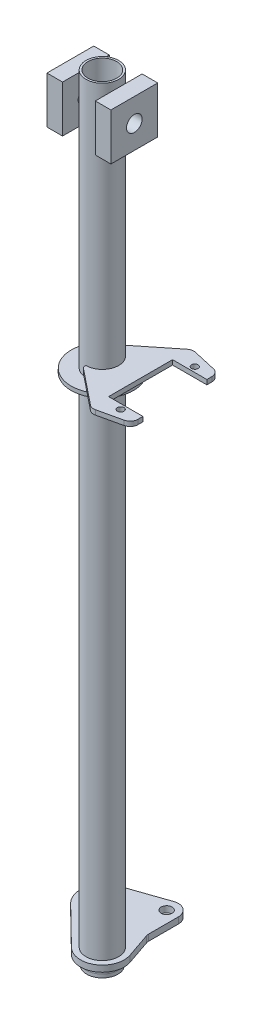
SolidWorks part; units mm, degrees
ref_plane "Plan de face" through (0, 0, 0) normal (0, 0, 1) x (1, 0, 0)
ref_plane "Plan de dessus" through (0, 0, 0) normal (0, 1, 0) x (1, 0, 0)
ref_plane "Plan de droite" through (0, 0, 0) normal (1, 0, 0) x (0, 0, -1)
sketch "Esquisse1" plane through (0, 0, 0) normal (0, 1, 0) x (1, 0, 0)
  line L0 (-57.9022, 78.2534) -> (-4.9011, 96.5767)
  line L1 (15, 82.4) -> (15, 44.3612)
  line L2 (15.5371, 41.128) -> (26.4961, 9.0529)
  line L3 (-19.5901, -20.0057) -> (-69.0894, 28.4653)
  circle A0 centre (0, 0) radius 21
  circle A1 centre (-48.1, 49.9) radius 15
  circle A2 centre (0, 82.4) radius 7
  arc A3 (-4.9011, 96.5767) -> (15, 82.4) centre (0, 82.4) cw
  arc A4 (26.4961, 9.0529) -> (-19.5901, -20.0057) centre (0, 0) cw
  arc A5 (-69.0894, 28.4653) -> (-57.9022, 78.2534) centre (-48.1, 49.9) cw
  arc A6 (15, 44.3612) -> (15.5371, 41.128) centre (25, 44.3612) ccw
  point P11 (15, 42.7)
  dimension "D1" = 30
  dimension "D2" = 42
  dimension "D3" = 14
  dimension "D4" = 15
  dimension "D5" = 28
  dimension "D6" = 30
  dimension "D12" = 10
  dimension "D7" = 49.9
  dimension "D8" = 48.1
  dimension "D9" = 48.1
  dimension "D10" = 82.4
  dimension "D11" = 42.7
extrude "Extrusion1" add sketch "Esquisse1" along normal blind 8
sketch "Esquisse2" plane through (0, 0, 0) normal (1, 0, 0) x (0, 0, -1)
  line L0 (0, -7) -> (0, 982)
  dimension "D1" = 7
  dimension "D2" = 989
other "Elément mécano-soudé1"
ref_plane "Plan1" through (0, -7, 0) normal (0, 1, 0) x (-1, 0, 0)
sketch "Esquisse11" plane through (0, -7, 0) normal (0, 1, 0) x (-1, 0, 0)
  line L0 (-21, 0) -> (21, 0) construction
  line L1 (0, 21) -> (0, -21) construction
  circle A0 centre (0, 0) radius 21
  circle A1 centre (0, 0) radius 18.5
  point P8 (0, 0)
  dimension "D1" = 37
  dimension "D2" = 42
inserted part "laser rondelle haut guidon"
move or copy body "Corps-Déplacer/Copier2" placed by mates yes
other "Distance1" parameters "D1"=638
other "<laser rondelle haut guidon>-<Extrusion1>"
sketch "Esquisse12" plane through (0, 8, 0) normal (0, 1, 0) x (-1, 0, 0)
  point P0 (48.1, -49.9)
ref_plane "Plan2" through (0, 0, 0) normal (-0.72, 0, 0.694) x (0.694, 0, 0.72)
sketch "Esquisse13" plane through (0, 0, 0) normal (-0.72, 0, 0.694) x (0.694, 0, 0.72)
  line L0 (-69.3082, -3) -> (-69.3082, 81)
  dimension "D1" = 11
  dimension "D2" = 73
other "Elément mécano-soudé2"
ref_plane "Plan3" through (-48.1, -3, -49.9) normal (0, 1, 0) x (-1, 0, 0)
sketch "Esquisse14" plane through (-48.1, -3, -49.9) normal (0, 1, 0) x (-1, 0, 0)
  line L0 (-15, 0) -> (15, 0) construction
  line L1 (0, 15) -> (0, -15) construction
  circle A0 centre (0, 0) radius 15
  point P7 (0, 0)
  dimension "D1" = 30
chamfer "Chanfrein1" distance 2 angle 45 1 edges at (-48.1, 81, -34.9)
sketch "Esquisse16" plane through (0, 0, 0) normal (1, 0, 0) x (0, 0, -1)
  line L0 (0, -7) -> (0, 982) construction
  line L1 (21, 982) -> (-21, 982) construction
  circle A0 centre (0, 943) radius 10
  dimension "D2" = 20
  dimension "D1" = 39
extrude "Enlèv. mat.-Extru.1" cut sketch "Esquisse16" against normal through all and the other way through all
inserted part "laser fix joystick"
move or copy body "Corps-Déplacer/Copier4" placed by mates yes
other "Distance3" parameters "D1"=7.3
other "<laser fix joystick>-<Extrusion1>"
sketch "Esquisse17" plane through (0, -7, 0) normal (0, -1, 0) x (1, 0, 0)
  circle A0 centre (0, 0) radius 20
  dimension "D1" = 40
extrude "Extrusion2" add sketch "Esquisse17" along normal blind 5 separate body
ref_plane "Plan4" through (21, 0, 0) normal (1, 0, 0) x (0, 0, -1)
ref_plane "Plan5" through (-21, 0, 0) normal (1, 0, 0) x (0, 0, -1)
sketch "Esquisse18" plane through (21, 0, 0) normal (1, 0, 0) x (0, 0, -1)
  line L0 (-30, 943) -> (30, 943)
  line L1 (30, 943) -> (-30, 943)
  point P3 (0, 943)
  dimension "D1" = 60
other "Elément mécano-soudé3"
ref_plane "Plan6" through (21, 943, 30) normal (0, 0, -1) x (-1, 0, 0)
sketch "Esquisse110" plane through (31, 943, 30) normal (0, 0, -1) x (-1, 0, 0)
  line L0 (-10, 0) -> (10, 0) construction
  line L1 (-10, 30) -> (10, 30)
  line L2 (-10, 30) -> (-10, -30)
  line L3 (-10, -30) -> (10, -30)
  line L4 (10, 30) -> (10, -30)
  line L5 (0, 30) -> (0, -30) construction
  point P8 (0, 0)
  dimension "D1" = 60
  dimension "D2" = 20
sketch "Esquisse111" plane through (-21, 0, 0) normal (1, 0, 0) x (0, 0, -1)
  line L0 (-30, 943) -> (30, 943)
other "Elément mécano-soudé5"
ref_plane "Plan8" through (-21, 943, 30) normal (0, 0, -1) x (-1, 0, 0)
sketch "Esquisse113" plane through (-31, 943, 30) normal (0, 0, -1) x (-1, 0, 0)
  line L0 (-10, 0) -> (10, 0) construction
  line L1 (-10, 30) -> (10, 30)
  line L2 (-10, 30) -> (-10, -30)
  line L3 (-10, -30) -> (10, -30)
  line L4 (10, 30) -> (10, -30)
  line L5 (0, 30) -> (0, -30) construction
  point P8 (0, 0)
  dimension "D1" = 60
  dimension "D2" = 20
sketch "Esquisse114" plane through (0, 0, 0) normal (1, 0, 0) x (0, 0, -1)
  line L0 (-30, 943) -> (30, 943) construction
  circle A0 centre (0, 943) radius 10
  dimension "D1" = 20
extrude "Enlèv. mat.-Extru.2" cut sketch "Esquisse114" against normal through all and the other way through all
